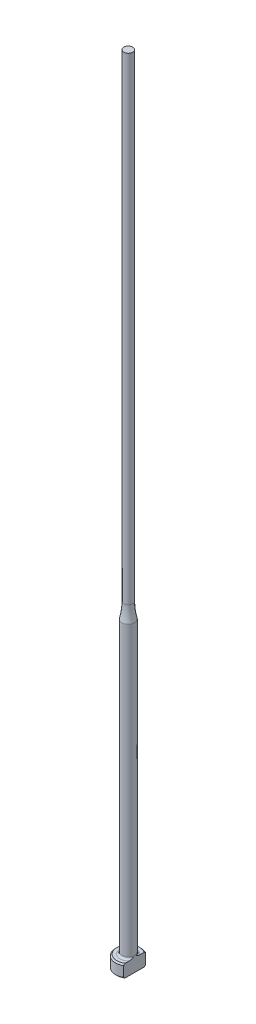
SolidWorks part; units mm, degrees
ref_plane "Front Plane" through (0, 0, 0) normal (0, 0, 1) x (1, 0, 0)
ref_plane "Top Plane" through (0, 0, 0) normal (0, 1, 0) x (1, 0, 0)
ref_plane "Right Plane" through (0, 0, 0) normal (1, 0, 0) x (0, 0, -1)
sketch "Sketch1" plane through (0, 0, 0) normal (0, 0, 1) x (1, 0, 0)
  line L0 (0, 259.9588) -> (0, -15.1925) construction
  line L1 (0, 0) -> (-2, 0)
  line L2 (-2, 0) -> (-2, 2)
  line L3 (-2, 2) -> (-1, 2)
  line L4 (-0.7, 50) -> (-0.7, 125)
  line L5 (-0.7, 125) -> (0, 125)
  line L6 (0, 125) -> (0, 0)
  line L7 (-1, 2) -> (-1, 47.569)
  arc A0 (-1, 47.569) -> (-0.7, 50) centre (-10.7, 50) ccw
  point P13 (-1, 0)
  dimension "D1" = 10
  dimension "L" = 125
  dimension "H" = 4
  dimension "T" = 2
  dimension "D" = 1.4
  dimension "B" = 2
  dimension "S" = 50
revolve "Revolve1" add sketch "Sketch1" angle 360 about L0
chamfer "Chamfer1" distance 0.2 angle 45 2 edges at (0, 2, 2) (0, 0, 2)
fillet "Fillet1" radius 0.3 1 edges at (0, 2, 1)
sketch "Sketch2" plane through (0, 0, 0) normal (0, 1, 0) x (1, 0, 0)
  line L0 (1, 1.7321) -> (1, -1.7321)
  circle A0 centre (0, 0) radius 2 construction
  arc A1 (1, -1.7321) -> (1, 1.7321) centre (0, 0) ccw
  circle A2 centre (0, 0) radius 1 construction
extrude "KEY" cut sketch "Sketch2" along normal through all
